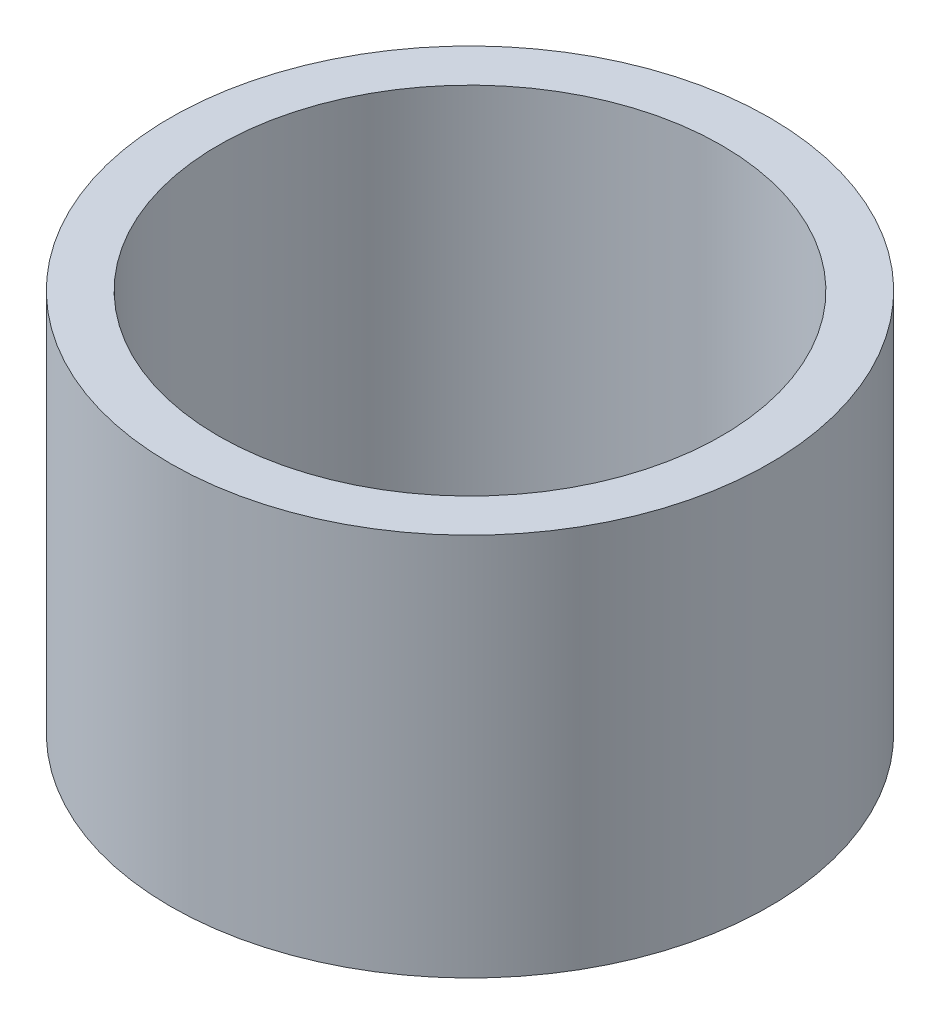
SolidWorks part; units mm, degrees
ref_plane "Front Plane" through (0, 0, 0) normal (0, 0, 1) x (1, 0, 0)
ref_plane "Top Plane" through (0, 0, 0) normal (0, 1, 0) x (1, 0, 0)
ref_plane "Right Plane" through (0, 0, 0) normal (1, 0, 0) x (0, 0, -1)
sketch "Sketch1" plane through (0, 0, 0) normal (0, 1, 0) x (1, 0, 0)
  circle A0 centre (0, 0) radius 7.9375
  circle A1 centre (0, 0) radius 6.6675
  dimension "D1" = 15.875
  dimension "D2" = 1.27
extrude "Boss-Extrude1" add sketch "Sketch1" along normal blind 10.16
